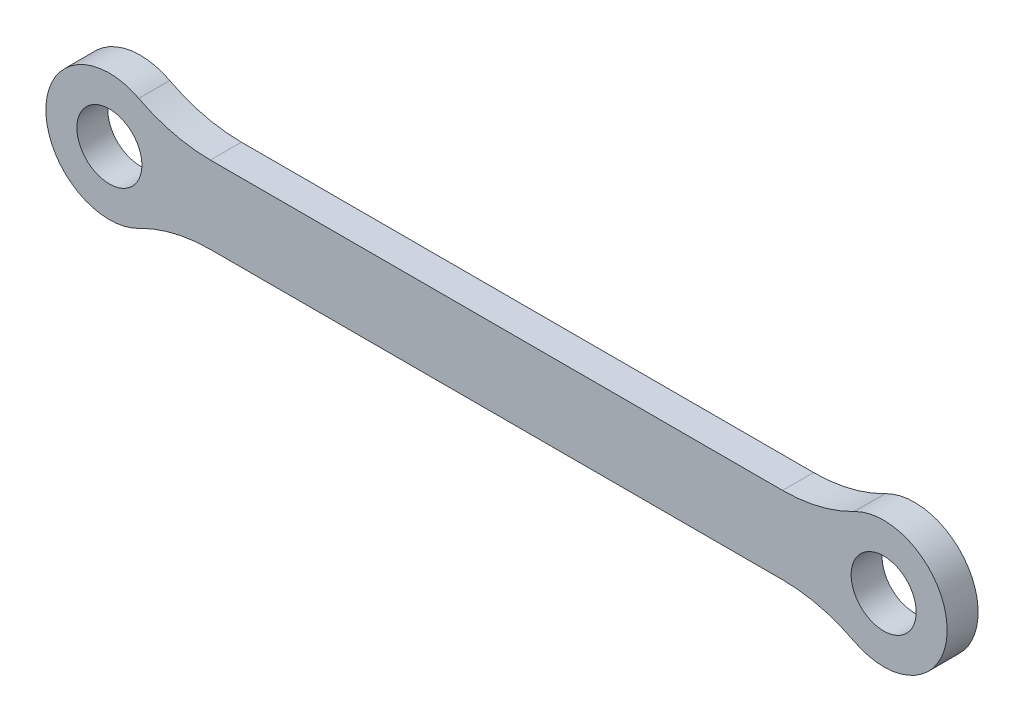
SolidWorks part; units mm, degrees
ref_plane "Plan de face" through (0, 0, 0) normal (0, 0, 1) x (1, 0, 0)
ref_plane "Plan de dessus" through (0, 0, 0) normal (0, 1, 0) x (1, 0, 0)
ref_plane "Plan de droite" through (0, 0, 0) normal (1, 0, 0) x (0, 0, -1)
sketch "Esquisse1" plane through (0, 0, 0) normal (0, 0, 1) x (1, 0, 0)
  line L0 (-25, 0) -> (25, 0) construction
  line L1 (-21.7504, 2.5) -> (21.7504, 2.5)
  line L2 (-21.7504, -2.5) -> (21.7504, -2.5)
  line L3 (0, 2.5) -> (0, -2.5) construction
  circle A0 centre (25, 0) radius 2.1
  arc A1 (21.7504, 2.5) -> (21.7504, -2.5) centre (25, 0) cw
  arc A2 (-21.7504, 2.5) -> (-21.7504, -2.5) centre (-25, 0) ccw
  circle A3 centre (-25, 0) radius 2.1
  point P10 (0, 0)
  dimension "D1" = 50
  dimension "D2" = 4.2
  dimension "D3" = 2
  dimension "D4" = 5
extrude "Boss.-Extru.1" add sketch "Esquisse1" along normal mid plane 2
fillet "Congé1" radius 10 4 edges at (-21.7504, -2.5, 0) (21.7504, -2.5, 0) (21.7504, 2.5, 0) (-21.7504, 2.5, 0)
